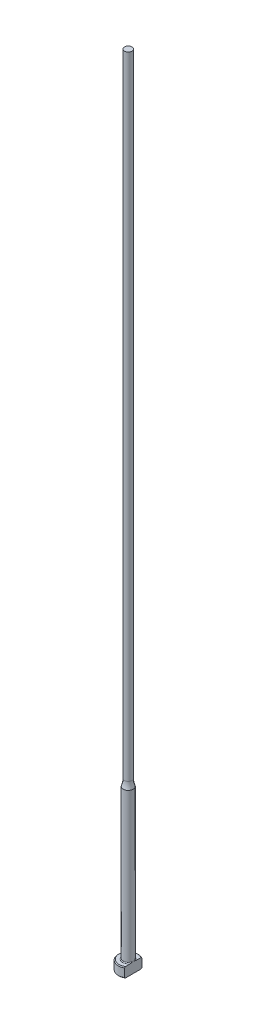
SolidWorks part; units mm, degrees
ref_plane "Front Plane" through (0, 0, 0) normal (0, 0, 1) x (1, 0, 0)
ref_plane "Top Plane" through (0, 0, 0) normal (0, 1, 0) x (1, 0, 0)
ref_plane "Right Plane" through (0, 0, 0) normal (1, 0, 0) x (0, 0, -1)
sketch "Sketch1" plane through (0, 0, 0) normal (0, 0, 1) x (1, 0, 0)
  line L0 (0, 259.9588) -> (0, -15.1925) construction
  line L1 (0, 0) -> (-3.175, 0)
  line L2 (-3.175, 0) -> (-3.175, 3.175)
  line L3 (-3.175, 3.175) -> (-1.5875, 3.175)
  line L4 (-1.19, 53.0114) -> (-1.19, 254)
  line L5 (-1.19, 254) -> (0, 254)
  line L6 (0, 254) -> (0, 0)
  line L7 (-1.5875, 3.175) -> (-1.5875, 50.8)
  arc A0 (-1.5875, 50.8) -> (-1.19, 53.0114) centre (-7.54, 53.0114) ccw
  point P13 (-1.5875, 0)
  dimension "D1" = 6.35
  dimension "L" = 254
  dimension "D2" = 3.175
  dimension "H" = 6.35
  dimension "T" = 3.175
  dimension "D" = 2.38
  dimension "S" = 50.8
revolve "Revolve1" add sketch "Sketch1" angle 360 about L0
chamfer "Chamfer1" distance 0.254 angle 45 2 edges at (0, 3.175, 3.175) (0, 0, 3.175)
fillet "Fillet1" radius 0.254 1 edges at (0, 3.175, 1.5875)
sketch "Sketch2" plane through (0, 0, 0) normal (0, 1, 0) x (1, 0, 0)
  line L0 (1.5875, -2.7496) -> (1.5875, 2.7496)
  circle A0 centre (0, 0) radius 3.175 construction
  arc A2 (1.5875, -2.7496) -> (1.5875, 2.7496) centre (0, 0) ccw
  circle A3 centre (0, 0) radius 3.175 construction
  circle A4 centre (0, 0) radius 1.5875 construction
extrude "Key Head" cut sketch "Sketch2" along normal up to next
